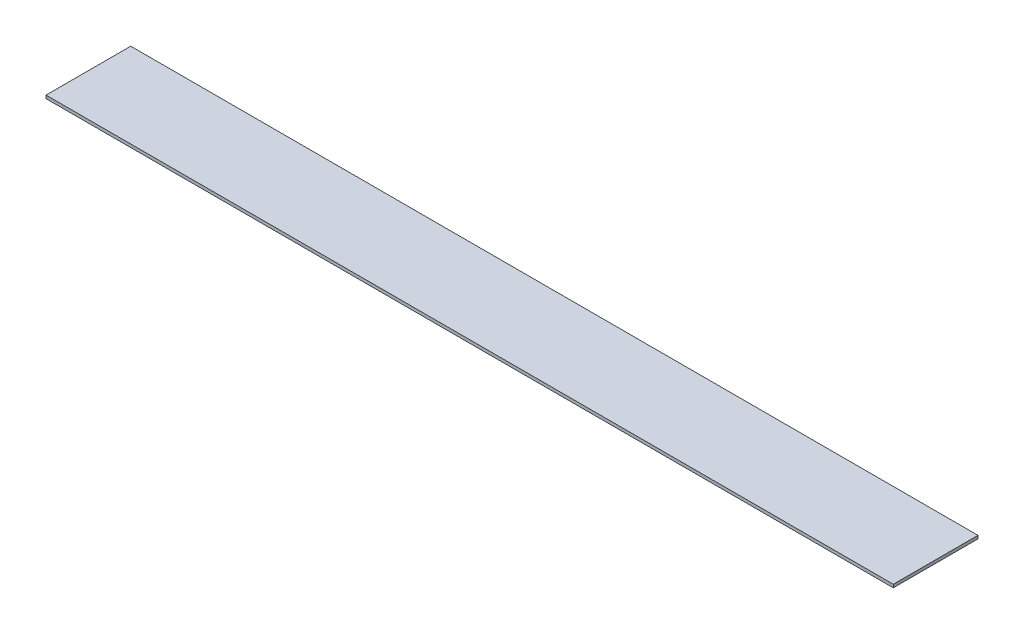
SolidWorks part; units mm, degrees
ref_plane "Plan de face" through (0, 0, 0) normal (0, 0, 1) x (1, 0, 0)
ref_plane "Plan de dessus" through (0, 0, 0) normal (0, 1, 0) x (1, 0, 0)
ref_plane "Plan de droite" through (0, 0, 0) normal (1, 0, 0) x (0, 0, -1)
sketch "Esquisse2" plane through (0, 0, 0) normal (0, 1, 0) x (1, 0, 0)
  line L0 (275, 27.5) -> (-275, -27.5) construction
  line L1 (275, -27.5) -> (-275, -27.5)
  line L2 (275, -27.5) -> (275, 27.5)
  line L3 (275, 27.5) -> (-275, 27.5)
  line L4 (-275, -27.5) -> (-275, 27.5)
  dimension "D1" = 55
  dimension "D2" = 550
extrude "Boss.-Extru.1" add sketch "Esquisse2" along normal blind 2
